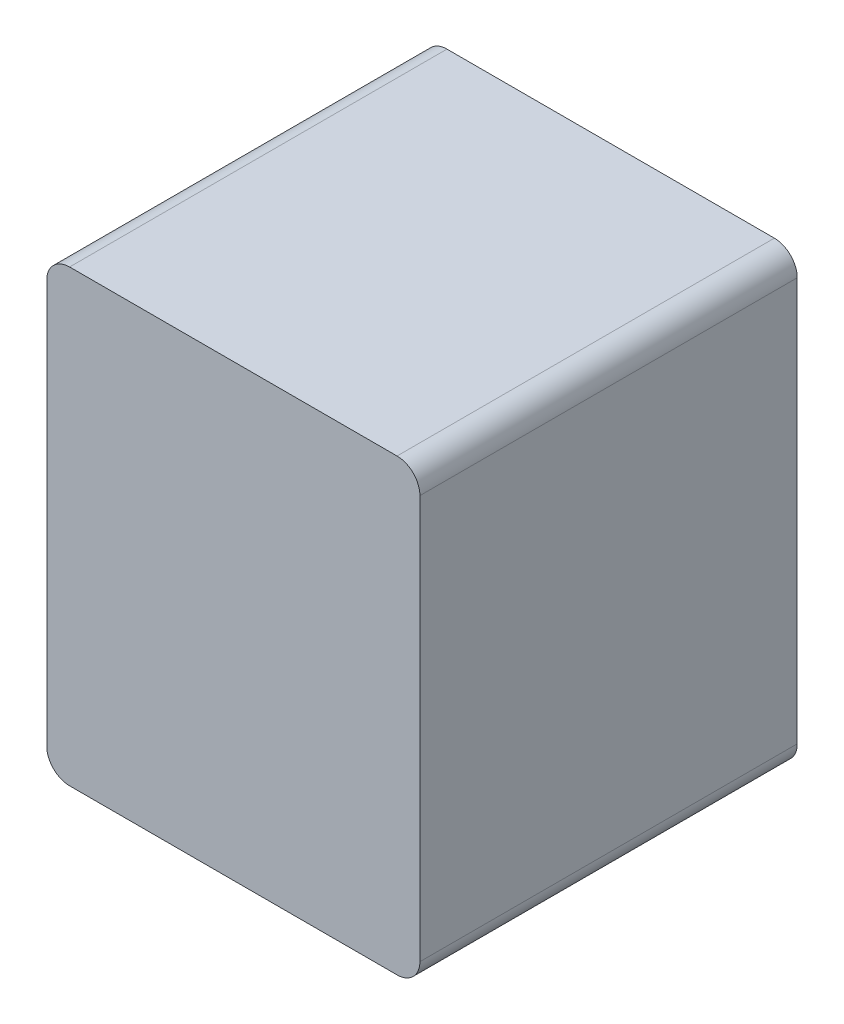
SolidWorks part; units mm, degrees
ref_plane "Ebene vorne" through (0, 0, 0) normal (0, 0, 1) x (1, 0, 0)
ref_plane "Ebene oben" through (0, 0, 0) normal (0, 1, 0) x (1, 0, 0)
ref_plane "Ebene rechts" through (0, 0, 0) normal (1, 0, 0) x (0, 0, -1)
sketch "Skizze2" plane through (0, 0, 0) normal (0, 0, 1) x (1, 0, 0)
  line L0 (-429.5, -1189.5) -> (429.5, -1189.5) construction
  line L1 (-489.5, -70.5) -> (-489.5, -1129.5) construction
  line L2 (0, -10.5) -> (-429.5, -10.5) construction
  line L3 (429.5, -10.5) -> (0, -10.5) construction
  line L4 (489.5, -1129.5) -> (489.5, -70.5) construction
  line L5 (-429.5, -1189.5) -> (429.5, -1189.5)
  line L6 (-489.5, -70.5) -> (-489.5, -1129.5)
  line L7 (0, -10.5) -> (-429.5, -10.5)
  line L8 (429.5, -10.5) -> (0, -10.5)
  line L9 (489.5, -1129.5) -> (489.5, -70.5)
  arc A0 (429.5, -1189.5) -> (489.5, -1129.5) centre (429.5, -1129.5) ccw construction
  arc A1 (-489.5, -1129.5) -> (-429.5, -1189.5) centre (-429.5, -1129.5) ccw construction
  arc A2 (-429.5, -10.5) -> (-489.5, -70.5) centre (-429.5, -70.5) ccw construction
  arc A3 (489.5, -70.5) -> (429.5, -10.5) centre (429.5, -70.5) ccw construction
  arc A4 (429.5, -1189.5) -> (489.5, -1129.5) centre (429.5, -1129.5) ccw
  arc A5 (-489.5, -1129.5) -> (-429.5, -1189.5) centre (-429.5, -1129.5) ccw
  arc A6 (-429.5, -10.5) -> (-489.5, -70.5) centre (-429.5, -70.5) ccw
  arc A7 (489.5, -70.5) -> (429.5, -10.5) centre (429.5, -70.5) ccw
extrude "Linear austragen1" add sketch "Skizze2" along normal blind 990
ref_plane "Ebene3" through (0, 0, 1007.5) normal (0, 0, 1) x (1, 0, 0)
sketch "Skizze8" plane through (0, 0, 1007.5) normal (0, 0, 1) x (1, 0, 0)
  line L0 (-489.5, -600) -> (489.5, -600) construction
  line L1 (-489.5, -70.5) -> (-489.5, -1129.5) construction
  line L2 (489.5, -1129.5) -> (489.5, -70.5) construction
  line L3 (0, -10.5) -> (0, -1189.5) construction
  line L5 (429.5, -10.5) -> (-429.5, -10.5) construction
  line L7 (-429.5, -1189.5) -> (429.5, -1189.5) construction
  circle A0 centre (0, -600) radius 75
  dimension "D1" = 150
sketch "Skizze9" plane through (0, 0, 990) normal (0, 0, 1) x (1, 0, 0)
  line L4 (489.5, -1129.5) -> (489.5, -70.5)
  line L5 (429.5, -10.5) -> (-429.5, -10.5)
  line L6 (-489.5, -70.5) -> (-489.5, -1129.5)
  line L7 (-429.5, -1189.5) -> (429.5, -1189.5)
  line L8 (489.5, -1129.5) -> (489.5, -70.5)
  line L9 (429.5, -10.5) -> (-429.5, -10.5)
  line L10 (-489.5, -70.5) -> (-489.5, -1129.5)
  line L11 (-429.5, -1189.5) -> (429.5, -1189.5)
  arc A4 (429.5, -1189.5) -> (489.5, -1129.5) centre (429.5, -1129.5) ccw
  arc A5 (489.5, -70.5) -> (429.5, -10.5) centre (429.5, -70.5) ccw
  arc A6 (-429.5, -10.5) -> (-489.5, -70.5) centre (-429.5, -70.5) ccw
  arc A7 (-489.5, -1129.5) -> (-429.5, -1189.5) centre (-429.5, -1129.5) ccw
  arc A8 (429.5, -1189.5) -> (489.5, -1129.5) centre (429.5, -1129.5) ccw
  arc A9 (489.5, -70.5) -> (429.5, -10.5) centre (429.5, -70.5) ccw
  arc A10 (-429.5, -10.5) -> (-489.5, -70.5) centre (-429.5, -70.5) ccw
  arc A11 (-489.5, -1129.5) -> (-429.5, -1189.5) centre (-429.5, -1129.5) ccw
  dimension "D1" = 0
loft "Ausformung1" [suppressed] add profiles "Skizze8", "Skizze9"
ref_plane "Ebene1" [suppressed] through (0, -600, 0) normal (0, 1, 0) x (-1, 0, 0)
sketch "Skizze3" plane through (0, 0, 0) normal (0, 0, -1) x (-1, 0, 0)
  line L0 (0, 0) -> (0, -1189.5) construction
  line L1 (429.5, -1189.5) -> (-429.5, -1189.5) construction
  line L2 (-489.5, -600) -> (489.5, -600) construction
  line L3 (-489.5, -1129.5) -> (-489.5, -70.5) construction
  line L4 (489.5, -70.5) -> (489.5, -1129.5) construction
  line L5 (-489.5, -1044) -> (-477.0019, -1064.1582)
  line L6 (-474, -1074.6969) -> (-474, -1114)
  line L7 (-414, -1174) -> (-374.6969, -1174)
  line L8 (-364.1582, -1177.0019) -> (-344, -1189.5)
  circle A0 centre (-489.5, -1100) radius 12.5 construction
  circle A1 centre (-375, -1189.5) radius 12.5 construction
  arc A2 (-414, -1174) -> (-474, -1114) centre (-414, -1114) cw
  arc A3 (-474, -1074.6969) -> (-477.0019, -1064.1582) centre (-494, -1074.6969) ccw
  arc A4 (-364.1582, -1177.0019) -> (-374.6969, -1174) centre (-374.6969, -1194) ccw
  point P24 (-474, -1069)
  point P27 (-369, -1174)
  dimension "D1" = 3
  dimension "D7" = 60
  dimension "D8" = 20
  dimension "D2" = 3
  dimension "D3" = 25
  dimension "D4" = 25
  dimension "D5" = 130
  dimension "D6" = 130
extrude "Schnitt-Linear austragen1" [suppressed] cut sketch "Skizze3" against normal through all and the other way through all flip side to cut
mirror "Spiegeln1" [suppressed] about plane through (0, 0, 0) normal (1, 0, 0)
mirror "Spiegeln2" [suppressed] about plane through (0, -600, 0) normal (0, 1, 0)
fillet "Verrundung1" [suppressed] radius 100
sketch "Skizze4" [suppressed] plane through (0, -10.5, 0) normal (0, 1, 0) x (1, 0, 0)
  line L1 (125, 0) -> (-125, 0)
  line L2 (125, 0) -> (125, -190)
  line L3 (65, -250) -> (-65, -250)
  line L4 (-125, 0) -> (-125, -190)
  line L5 (0, 0) -> (0, -281.2746) construction
  line L6 (-389.5, 0) -> (389.5, 0) construction
  arc A0 (65, -250) -> (125, -190) centre (65, -190) ccw
  arc A1 (-125, -190) -> (-65, -250) centre (-65, -190) ccw
  dimension "D3" = 60
  dimension "D1" = 125
  dimension "D2" = 250
extrude "Schnitt-Linear austragen2" [suppressed] cut sketch "Skizze4" against normal blind 100
draft "Formschräge1" [suppressed] type of draft neutral plane draft angle 25 faces to draft 5 parameters "D1"=25
sketch "Skizze5" [suppressed] plane through (0, 0, 0) normal (0, 0, 1) x (1, 0, 0)
  line L0 (-474, -86) -> (-474, -125.3031) construction
  line L2 (-477, -300) -> (-502, -300) construction
  line L3 (-514, -350) -> (-514, -450)
  line L4 (-514, -650) -> (-514, -550)
  line L5 (-514, -750) -> (-514, -850)
  line L6 (-514, -950) -> (-534, -950)
  line L7 (-534, -950) -> (-534, -250)
  line L8 (-534, -250) -> (-514, -250)
  line L9 (0, -10.5) -> (0, -1189.5) construction
  line L10 (-429.5, -1189.5) -> (429.5, -1189.5) construction
  line L11 (514, -950) -> (534, -950)
  line L12 (514, -750) -> (514, -850)
  line L13 (514, -650) -> (514, -550)
  line L14 (514, -350) -> (514, -450)
  line L15 (534, -250) -> (514, -250)
  line L16 (534, -950) -> (534, -250)
  line L18 (-125, 2) -> (-125, -23) construction
  line L19 (75, 14) -> (-75, 14)
  line L20 (175, 14) -> (175, 25.25)
  line L21 (175, 25.25) -> (-175, 25.25)
  line L22 (-175, 25.25) -> (-175, 14)
  line L23 (489.5, -600) -> (-489.5, -600) construction
  line L24 (489.5, -1129.5) -> (489.5, -70.5) construction
  line L25 (-489.5, -70.5) -> (-489.5, -1129.5) construction
  line L26 (175, -1214) -> (175, -1225.25)
  line L27 (75, -1214) -> (-75, -1214)
  line L28 (-175, -1225.25) -> (-175, -1214)
  line L29 (175, -1225.25) -> (-175, -1225.25)
  line L30 (-374.6969, -26) -> (-414, -26) construction
  arc A0 (-514, -350) -> (-514, -250) centre (-525.25, -300) ccw
  circle A1 centre (-489.5, -300) radius 12.5 construction
  arc A2 (-514, -550) -> (-514, -450) centre (-525.25, -500) ccw
  arc A3 (-514, -750) -> (-514, -650) centre (-525.25, -700) ccw
  arc A4 (-514, -950) -> (-514, -850) centre (-525.25, -900) ccw
  arc A5 (514, -950) -> (514, -850) centre (525.25, -900) cw
  arc A6 (514, -750) -> (514, -650) centre (525.25, -700) cw
  arc A7 (514, -550) -> (514, -450) centre (525.25, -500) cw
  arc A8 (514, -350) -> (514, -250) centre (525.25, -300) cw
  arc A9 (-75, 14) -> (-175, 14) centre (-125, 25.25) cw
  circle A10 centre (-125, -10.5) radius 12.5 construction
  arc A11 (75, 14) -> (175, 14) centre (125, 25.25) ccw
  arc A12 (75, -1214) -> (175, -1214) centre (125, -1225.25) cw
  arc A13 (-75, -1214) -> (-175, -1214) centre (-125, -1225.25) ccw
  dimension "D1" = 100
  dimension "D2" = 200
  dimension "D3" = 40
  dimension "D4" = 20
  dimension "D5" = 40
  dimension "D6" = 100
extrude "Schnitt-Linear austragen3" [suppressed] cut sketch "Skizze5" along normal through all
fillet "Verrundung2" [suppressed] radius 20
fillet "Verrundung3" [suppressed] radius 20
fillet "Verrundung4" [suppressed] radius 20
fillet "Verrundung5" [suppressed] radius 20
ref_plane "Ebene2" [suppressed] through (0, -50.5, 0) normal (0, 1, 0) x (-1, 0, 0)
sketch "Skizze7" [suppressed] plane through (0, -50.5, 0) normal (0, 1, 0) x (-1, 0, 0)
  line L0 (0, 0) -> (0, 134.4557) construction
  line L1 (-112.2586, 20) -> (112.2586, 20) construction
  circle A0 centre (0, 51) radius 31
  dimension "D1" = 62
extrude "Linear austragen2" [suppressed] add sketch "Skizze7" against normal up to body separate body
fillet "Verrundung6" [suppressed] radius 10
sketch "Skizze10" [suppressed] plane through (0, 0, 1007.5) normal (0, 0, 1) x (1, 0, 0)
  circle A1 centre (0, -600) radius 75
  circle A2 centre (0, -600) radius 75
  dimension "D1" = 0
extrude "Linear austragen3" [suppressed] add sketch "Skizze10" along normal blind 35
sketch "Skizze11" [suppressed] plane through (-489.5, 0, 0) normal (1, 0, 0) x (0, 0, -1)
  line L0 (-1042.5, -600) -> (-894.1329, -600) construction
  line L1 (-1042.5, -525) -> (-1042.5, -675) construction
  line L2 (-1013.9327, -645.9627) -> (-1052.5, -678.3244)
  line L3 (-1013.9327, -554.0373) -> (-1052.5, -521.6756)
  line L4 (-1052.5, -521.6756) -> (-1052.5, -678.3244)
  arc A0 (-894.1285, -544.3678) -> (-894.1285, -655.6322) centre (350792.0259, -600) ccw construction
  arc A1 (-1013.9327, -554.0373) -> (-1013.9327, -645.9627) centre (-1052.5, -600) cw
  dimension "D1" = 60
  dimension "D2" = 50
  dimension "D3" = 40
extrude "Schnitt-Linear austragen4" [suppressed] cut sketch "Skizze11" along normal up to surface (1297.9948 mm away)
fillet "Verrundung10" [suppressed] radius 5
fillet "Verrundung11" [suppressed] radius 20
shell "Wandung1" [suppressed] thickness 3
